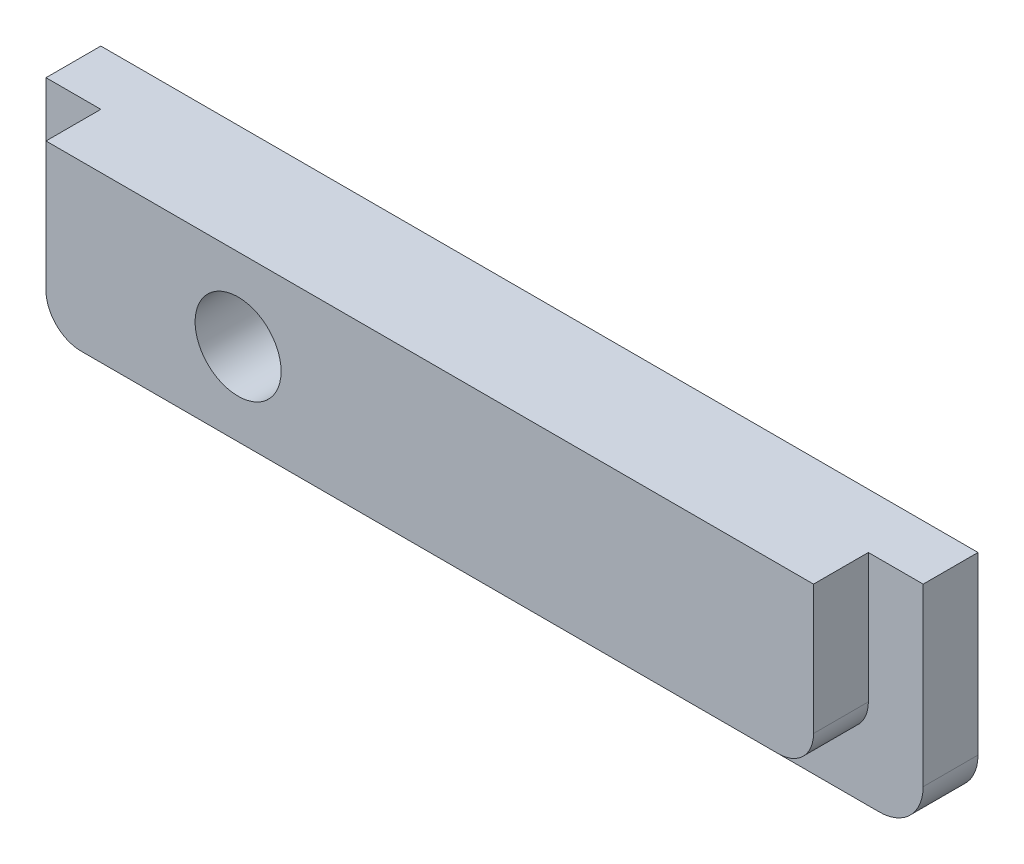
SolidWorks part; units mm, degrees
ref_plane "Front Plane" through (0, 0, 0) normal (0, 0, 1) x (1, 0, 0)
ref_plane "Top Plane" through (0, 0, 0) normal (0, 1, 0) x (1, 0, 0)
ref_plane "Right Plane" through (0, 0, 0) normal (1, 0, 0) x (0, 0, -1)
sketch "Sketch1" plane through (0, 0, 0) normal (0, 0, 1) x (1, 0, 0)
  line L0 (0, 0) -> (44.45, 0)
  line L1 (44.45, 0) -> (44.45, 9.525)
  line L2 (44.45, 9.525) -> (0, 9.525)
  line L3 (0, 9.525) -> (0, 0)
  line L4 (0, 9.525) -> (-3.175, 9.525)
  line L5 (-3.175, 9.525) -> (-3.175, -3.175)
  line L6 (-3.175, -3.175) -> (47.625, -3.175)
  line L7 (47.625, -3.175) -> (47.625, 9.525)
  line L8 (47.625, 9.525) -> (44.45, 9.525)
  circle A0 centre (11.1252, 4.7752) radius 2.4892
  circle A1 centre (33.3248, 4.7752) radius 2.4892
  dimension "D7" = 4.9784
  dimension "D1" = 3.175
  dimension "D2" = 3.175
  dimension "D3" = 9.525
  dimension "D4" = 44.45
  dimension "D5" = 11.1252
  dimension "D6" = 4.7752
  dimension "D8" = 11.1252
sketch "Sketch2" plane through (0, 0, 0) normal (0, 0, 1) x (1, 0, 0)
  line L0 (0, 9.525) -> (0, 0) construction
  line L1 (0, 0) -> (44.45, 0) construction
  line L2 (44.45, 0) -> (44.45, 9.525) construction
  line L3 (44.45, 9.525) -> (0, 9.525) construction
  line L4 (0, 9.525) -> (0, 0)
  line L5 (0, 0) -> (44.45, 0)
  line L6 (44.45, 0) -> (44.45, 9.525)
  line L7 (44.45, 9.525) -> (0, 9.525)
extrude "Boss-Extrude1" add sketch "Sketch2" along normal blind 3.175
sketch "Sketch3" plane through (0, 0, 0) normal (0, 0, 1) x (1, 0, 0)
  line L0 (-3.175, -3.175) -> (47.625, -3.175) construction
  line L1 (-3.175, 9.525) -> (-3.175, -3.175) construction
  line L2 (0, 9.525) -> (-3.175, 9.525) construction
  line L3 (44.45, 9.525) -> (0, 9.525) construction
  line L4 (47.625, 9.525) -> (44.45, 9.525) construction
  line L5 (47.625, -3.175) -> (47.625, 9.525) construction
  line L6 (-3.175, -3.175) -> (47.625, -3.175)
  line L7 (-3.175, 9.525) -> (-3.175, -3.175)
  line L8 (0, 9.525) -> (-3.175, 9.525)
  line L9 (44.45, 9.525) -> (0, 9.525)
  line L10 (47.625, 9.525) -> (44.45, 9.525)
  line L11 (47.625, -3.175) -> (47.625, 9.525)
extrude "Boss-Extrude2" add sketch "Sketch3" against normal blind 3.175
fillet "Fillet1" radius 2.032 2 edges at (44.45, 0, 1.5875) (0, 0, 1.5875)
fillet "Fillet2" radius 2.54 2 edges at (47.625, -3.175, -1.5875) (-3.175, -3.175, -1.5875)
sketch "Sketch4" [suppressed] plane through (0, 0, 0) normal (0, 0, 1) x (1, 0, 0)
  circle A0 centre (33.3248, 4.7752) radius 2.4892 construction
  circle A1 centre (33.3248, 4.7752) radius 2.4892
extrude "Cut-Extrude1" [suppressed] cut sketch "Sketch4" against normal mid plane 25.4
sketch "Sketch5" plane through (0, 0, 0) normal (0, 0, 1) x (1, 0, 0)
  circle A0 centre (11.1252, 4.7752) radius 2.4892 construction
  circle A1 centre (11.1252, 4.7752) radius 2.4892
extrude "Cut-Extrude2" cut sketch "Sketch5" against normal mid plane 25.4
